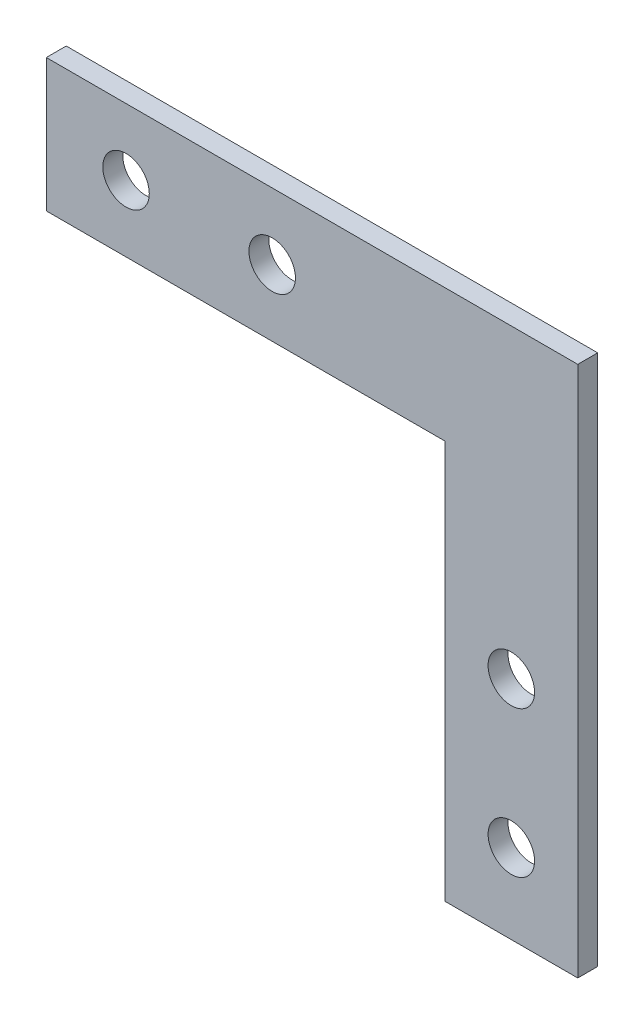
SolidWorks part; units mm, degrees
ref_plane "Plan de face" through (0, 0, 0) normal (0, 0, 1) x (1, 0, 0)
ref_plane "Plan de dessus" through (0, 0, 0) normal (0, 1, 0) x (1, 0, 0)
ref_plane "Plan de droite" through (0, 0, 0) normal (1, 0, 0) x (0, 0, -1)
sketch "Esquisse1" plane through (0, 0, 0) normal (0, 0, 1) x (1, 0, 0)
  line L1 (0, 0) -> (60, 0)
  line L2 (0, 0) -> (0, 20)
  line L3 (0, 20) -> (80, 20)
  line L4 (80, 0) -> (80, 20)
  line L6 (80, 0) -> (80, -60)
  line L7 (80, -60) -> (60, -60)
  line L8 (60, 0) -> (60, -60)
  circle A0 centre (12, 10) radius 3.5
  circle A1 centre (34, 10) radius 3.5
  circle A2 centre (70, -48) radius 3.5
  circle A3 centre (70, -26) radius 3.5
  dimension "D3" = 7
  dimension "D4" = 7
  dimension "D5" = 80
  dimension "D6" = 20
  dimension "D8" = 22
  dimension "D9" = 7
  dimension "D10" = 7
  dimension "D12" = 12
  dimension "D13" = 22
  dimension "D14" = 10
  dimension "D15" = 10
  dimension "D1" = 20
  dimension "D2" = 80
  dimension "D7" = 12
  dimension "D11" = 10
extrude "Extrusion1" add sketch "Esquisse1" along normal blind 3
